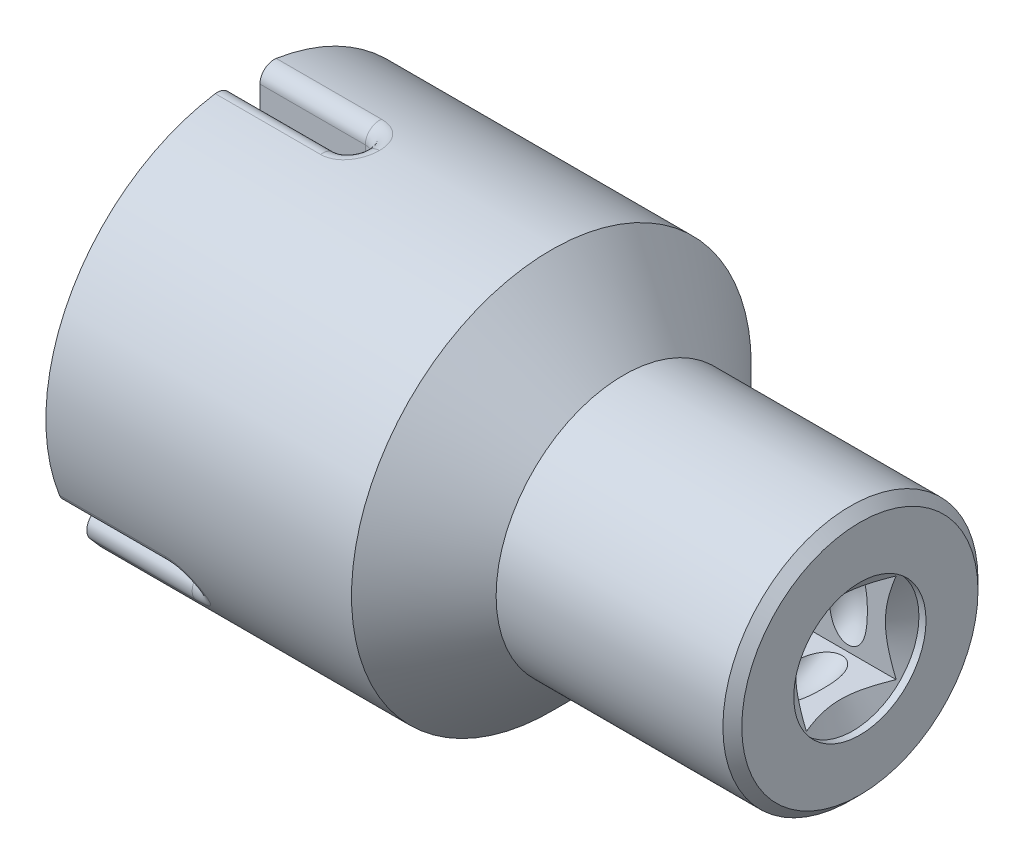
SolidWorks part; units mm, degrees
ref_plane "Plan de face" through (0, 0, 0) normal (0, 0, 1) x (1, 0, 0)
ref_plane "Plan de dessus" through (0, 0, 0) normal (0, 1, 0) x (1, 0, 0)
ref_plane "Plan de droite" through (0, 0, 0) normal (1, 0, 0) x (0, 0, -1)
sketch "Esquisse1" plane through (0, 0, 0) normal (0, 0, 1) x (1, 0, 0)
  line L0 (229.8097, 0) -> (67.6269, 0) construction
  line L1 (217.2, 27) -> (217.2, 14)
  line L2 (212.8132, 9) -> (215.7, 14)
  line L3 (100.5, 44.3056) -> (75.5, 44.3056) construction
  line L4 (212.8132, 9) -> (140.6555, 9)
  line L5 (87.2, 32.3056) -> (87.2, 42.3056)
  line L6 (87.2, 42.3056) -> (151.8944, 42.3056)
  line L8 (217.2, 27) -> (167.2, 27)
  line L9 (221.7, 27) -> (217.2, 27) construction
  line L10 (215.7, 14) -> (217.2, 14)
  line L11 (167.2, 27) -> (151.8944, 42.3056)
  line L12 (117.2, -51) -> (117.2, 51) construction
  line L13 (217.2, 27) -> (217.2, -27) construction
  line L16 (87.2, 32.3056) -> (121.4265, 32.3056)
  line L17 (130.0868, 27.3056) -> (140.6555, 9)
  arc A0 (121.4265, 32.3056) -> (130.0868, 27.3056) centre (121.4265, 22.3056) cw
  point P21 (127.2, 32.3056)
  dimension "D8" = 10
  dimension "D2" = 30
  dimension "D3" = 50
  dimension "D4" = 45
  dimension "D5" = 60
  dimension "D6" = 10
  dimension "D7" = 40
  dimension "D9" = 28
  dimension "D10" = 18
  dimension "D11" = 60
  dimension "D12" = 1.5
  dimension "D13" = 2
revolve "Révolution1" add sketch "Esquisse1" angle 360 about L0
sketch "Esquisse2" plane through (217.2, 0, 0) normal (1, 0, 0) x (0, 0, -1)
  line L1 (-9.5, 9.5) -> (9.5, 9.5)
  line L2 (-9.5, 9.5) -> (-9.5, -9.5)
  line L3 (-9.5, -9.5) -> (9.5, -9.5)
  line L4 (9.5, 9.5) -> (9.5, -9.5)
  line L5 (-9.5, 9.5) -> (9.5, -9.5) construction
  line L6 (-9.5, -9.5) -> (9.5, 9.5) construction
  point P0 (0, 0)
  dimension "D1" = 19
extrude "Enlèv. mat.-Extru.1" cut sketch "Esquisse2" against normal up to next
fillet "Congé4" [suppressed] radius 3
chamfer "Chanfrein1" distance 2 angle 45 1 edges at (217.2, 0, -27)
sketch "Esquisse3" plane through (87.2, 0, 0) normal (-1, 0, 0) x (0, 0, 1)
  line L0 (0, 0) -> (0, 32.3056) construction
  line L1 (3, 42.1991) -> (3, 32.166)
  line L2 (0, 0) -> (27.9775, -16.1528) construction
  line L3 (-3, 42.1991) -> (-3, 32.166)
  line L5 (0, 0) -> (-27.9775, -16.1528) construction
  line L6 (-38.0455, -18.5015) -> (-29.3566, -13.4849)
  line L7 (29.3566, -13.4849) -> (38.0455, -18.5015)
  line L8 (26.3566, -18.6811) -> (35.0455, -23.6976)
  line L10 (-35.0455, -23.6976) -> (-26.3566, -18.6811)
  circle A0 centre (0, 0) radius 42.3056 construction
  circle A1 centre (0, 0) radius 32.3056 construction
  arc A2 (-38.0455, -18.5015) -> (-35.0455, -23.6976) centre (0, 0) ccw
  arc A3 (-29.3566, -13.4849) -> (-26.3566, -18.6811) centre (0, 0) ccw
  arc A4 (26.3566, -18.6811) -> (29.3566, -13.4849) centre (0, 0) ccw
  arc A5 (35.0455, -23.6976) -> (38.0455, -18.5015) centre (0, 0) ccw
  arc A6 (3, 42.1991) -> (-3, 42.1991) centre (0, 0) ccw
  arc A7 (3, 32.166) -> (-3, 32.166) centre (0, 0) ccw
  dimension "D1" = 120
  dimension "D2" = 6
  dimension "D3" = 6
  dimension "D4" = 6
extrude "Enlèv. mat.-Extru.2" cut sketch "Esquisse3" against normal up to vertex
fillet "Congé1" radius 3 6 edges at (112.5, 37.1825, -3) (112.5, 37.1825, 3) (112.5, -21.1893, -30.701) (112.5, -15.9932, -33.701) (112.5, -21.1893, 30.701) (112.5, -15.9932, 33.701)
fillet "Congé2" radius 3 12 edges at (98.35, -18.5015, -38.0455) (111.8447, -19.5114, -37.5375) (111.3714, -23.1509, -35.409) (98.35, -23.6976, 35.0455) (111.8447, -22.7528, 35.6661) (111.3714, -19.0897, 37.7538) (98.35, 42.1991, 3) (111.8447, 42.2642, 1.8714) (111.3714, 42.2406, -2.3448) (98.35, -23.6976, -35.0455) (98.35, -18.5015, 38.0455) (98.35, 42.1991, -3)
sketch "Esquisse4" plane through (0, 0, 0) normal (0, 0, 1) x (1, 0, 0)
  line L0 (217.2, -25) -> (217.2, 25) construction
  line L2 (174.4011, 0) -> (207.5175, 0) construction
  circle A0 centre (205.2, 8.3) radius 4.25
  dimension "D2" = 8.5
  dimension "D1" = 12
  dimension "D3" = 8.3
revolve "Enlèvement de matière-Révolution1" cut sketch "Esquisse4" angle 360 about L2
